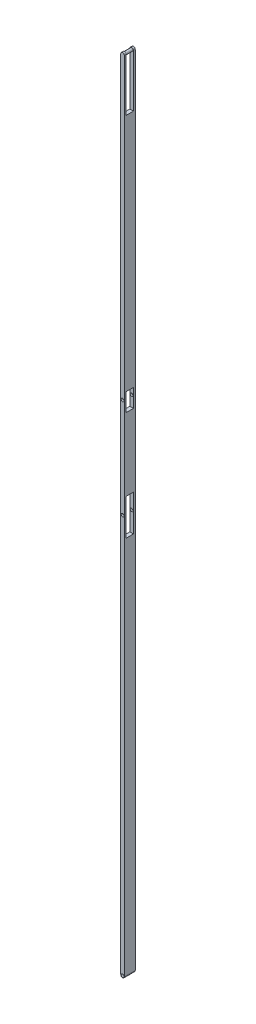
SolidWorks part; units mm, degrees
ref_plane "Ebene vorne" through (0, 0, 0) normal (0, 0, 1) x (1, 0, 0)
ref_plane "Ebene oben" through (0, 0, 0) normal (0, 1, 0) x (1, 0, 0)
ref_plane "Ebene rechts" through (0, 0, 0) normal (1, 0, 0) x (0, 0, -1)
sketch "Skizze2" plane through (0, 0, 0) normal (0, 0, 1) x (1, 0, 0)
  line L0 (-5, 0) -> (-5, 2200)
  line L2 (5, 2200) -> (5, 0)
  arc A0 (-5, 0) -> (5, 0) centre (0, 0) ccw
  arc A2 (5, 2200) -> (-5, 2200) centre (0, 2200) ccw
  dimension "D1" = 10
  dimension "D3" = 10
  dimension "D2" = 2200
extrude "Aufsatz-Linear austragen1" add sketch "Skizze2" along normal blind 30
sketch "Skizze3" plane through (5, 0, 0) normal (1, 0, 0) x (0, 0, -1)
  line L0 (-30, -5) -> (0, -5) construction
  line L1 (-25, 1395) -> (-5, 1395)
  line L2 (-25, 1395) -> (-25, 1345)
  line L3 (-25, 1345) -> (-5, 1345)
  line L4 (-5, 1395) -> (-5, 1345)
  line L8 (-30, 0) -> (-30, 2200) construction
  dimension "D1" = 20
  dimension "D2" = 1350
  dimension "D3" = 50
  dimension "D4" = 5
extrude "Schnitt-Linear austragen1" cut sketch "Skizze3" against normal through all
sketch "Skizze5" plane through (0, 0, 0) normal (0, 0, -1) x (-1, 0, 0)
  line L0 (-5, 0) -> (-5, 2200) construction
  circle A0 centre (0, 1100) radius 4
  arc A2 (-5, 0) -> (5, 0) centre (0, 0) ccw construction
  dimension "D1" = 8
  dimension "D3" = 1100
  dimension "D2" = 5
sketch "Skizze11" plane through (0, 0, 0) normal (0, 0, -1) x (-1, 0, 0)
  line L0 (5, 2200) -> (5, 0) construction
  circle A0 centre (0, 1375) radius 4
  arc A1 (-5, 0) -> (5, 0) centre (0, 0) ccw construction
  dimension "D1" = 8
  dimension "D2" = 1375
  dimension "D3" = 5
extrude "Schnitt-Linear austragen8" cut sketch "Skizze11" against normal through all
extrude "Schnitt-Linear austragen3" cut sketch "Skizze5" against normal through all
sketch "Skizze6" plane through (5, 0, 0) normal (1, 0, 0) x (0, 0, -1)
  line L0 (-30, 0) -> (-30, 2200) construction
  line L1 (-25, 1145) -> (-5, 1145)
  line L2 (-25, 1145) -> (-25, 1045)
  line L3 (-25, 1045) -> (-5, 1045)
  line L4 (-5, 1145) -> (-5, 1045)
  line L5 (-30, -5) -> (0, -5) construction
  dimension "D1" = 20
  dimension "D2" = 100
  dimension "D3" = 5
  dimension "D4" = 1050
extrude "Schnitt-Linear austragen4" cut sketch "Skizze6" against normal through all
sketch "Skizze7" plane through (0, 0, 30) normal (0, 0, 1) x (1, 0, 0)
  circle A0 centre (0, 0) radius 4
  dimension "D1" = 8
extrude "Schnitt-Linear austragen5" cut sketch "Skizze7" against normal through all
sketch "Skizze9" plane through (-5, 0, 0) normal (-1, 0, 0) x (0, 0, 1)
  line L0 (30, 2205) -> (0, 2205) construction
  line L1 (25, 2205) -> (5, 2205)
  line L2 (25, 2205) -> (25, 2055)
  line L3 (25, 2055) -> (5, 2055)
  line L4 (5, 2205) -> (5, 2055)
  line L5 (0, 2205) -> (0, 2200) construction
  dimension "D1" = 150
  dimension "D2" = 20
  dimension "D3" = 5
extrude "Schnitt-Linear austragen7" cut sketch "Skizze9" against normal through all
sketch "Skizze10" plane through (0, 0, 0) normal (0, 0, -1) x (-1, 0, 0)
  circle A0 centre (0, 2200) radius 4
  dimension "D1" = 8
extrude "Aufsatz-Linear austragen2" add sketch "Skizze10" against normal up to surface (25 mm away)
